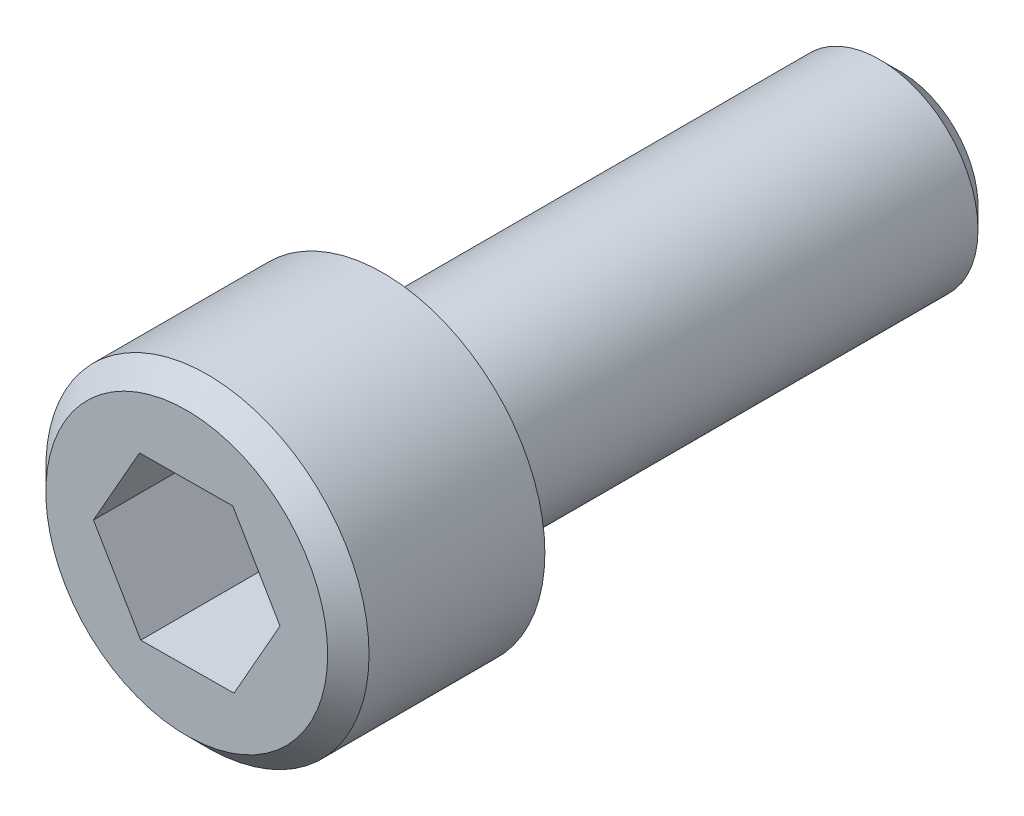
SolidWorks part; units mm, degrees
ref_plane "Plane1" through (0, 0, 0) normal (0, 0, 1) x (1, 0, 0)
ref_plane "Plane2" through (0, 0, 0) normal (0, 1, 0) x (1, 0, 0)
ref_plane "Plane3" through (0, 0, 0) normal (1, 0, 0) x (0, 0, -1)
sketch "Sketch1" plane through (0, 0, 0) normal (0, 0, 1) x (1, 0, 0)
  circle A0 centre (0, 0) radius 3.9688
  dimension "head_dia" = 7.9375
extrude "Head" add sketch "Sketch1" along normal blind 4.826
chamfer "Chamfer1" distance 0.508 angle 45 1 edges at (3.9688, 0, 4.826)
sketch "Sketch2" plane through (0, 0, 4.826) normal (0, 0, 1) x (1, 0, 0)
  line L1 (-1.13, -1.9925) -> (1.1605, -1.9749)
  line L2 (1.1605, -1.9749) -> (2.2906, 0.0176)
  line L3 (2.2906, 0.0176) -> (1.13, 1.9925)
  line L4 (1.13, 1.9925) -> (-1.1605, 1.9749)
  line L5 (-1.1605, 1.9749) -> (-2.2906, -0.0176)
  line L6 (-2.2906, -0.0176) -> (-1.13, -1.9925)
  circle A0 centre (0, 0) radius 1.9837 construction
  circle A2 centre (0, 0) radius 3.9688 construction
  dimension "hex" = 3.9675
extrude "Cut-Extrude1" cut sketch "Sketch2" against normal blind 3.175
sketch "Sketch3" plane through (0, 0, 0) normal (0, 0, -1) x (-1, 0, 0)
  circle A0 centre (0, 0) radius 2.413
  circle A1 centre (0, 0) radius 3.9688 construction
  dimension "thread_dia" = 4.826
extrude "Boss-Extrude1" add sketch "Sketch3" along normal blind 12.7
chamfer "Chamfer2" distance 0.508 angle 45 1 edges at (-2.413, 0, -12.7)
